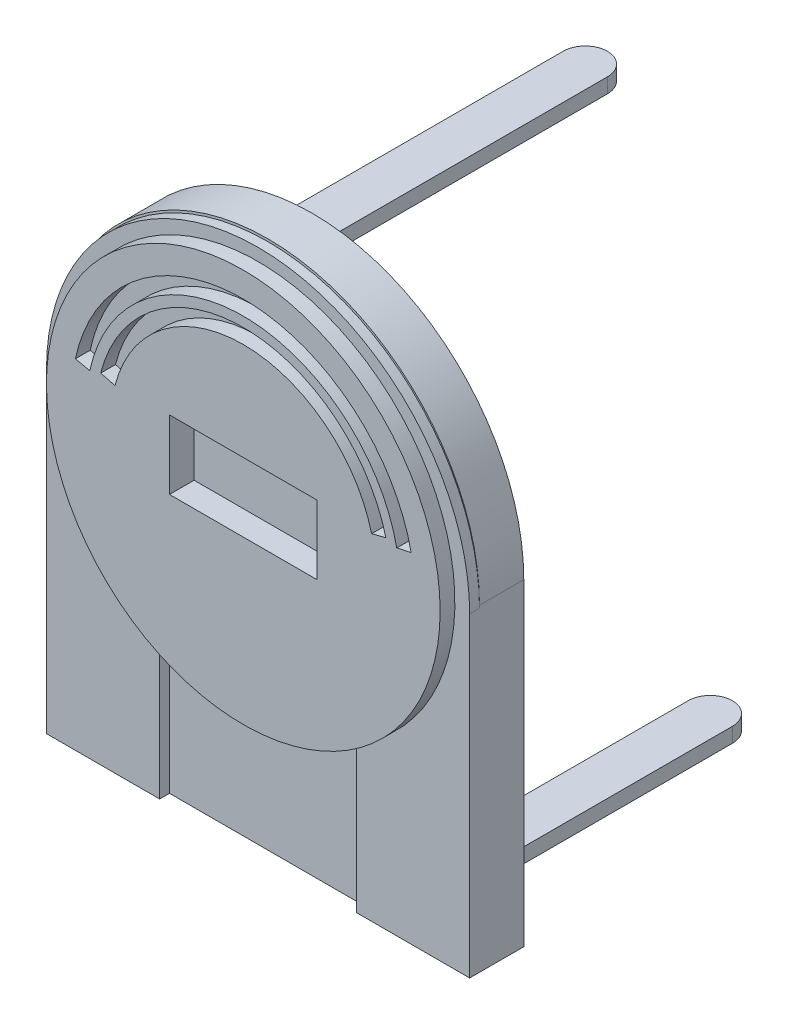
SolidWorks part; units mm, degrees
ref_plane "Face" through (0, 0, 0) normal (0, 0, 1) x (1, 0, 0)
ref_plane "Dessus" through (0, 0, 0) normal (0, 1, 0) x (1, 0, 0)
ref_plane "Droite" through (0, 0, 0) normal (1, 0, 0) x (0, 0, -1)
sketch "Esquisse1" plane through (0, 0, 0) normal (0, 0, 1) x (1, 0, 0)
  line L0 (-9.1364, 0) -> (18.4133, 0) construction
  line L1 (0, 15.4616) -> (0, -6.4658) construction
  line L2 (-9.1364, 10.16) -> (8.293, 10.16) construction
  line L3 (-2.54, 11.2868) -> (-2.54, -1.6571) construction
  line L4 (2.54, 10.9378) -> (2.54, -1.3709) construction
  line L5 (-4.3, 11.6992) -> (-4.3, -1.0854) construction
  line L6 (-4.8945, -0.3) -> (3.5763, -0.3) construction
  line L7 (-5.3386, 10.46) -> (3.5763, 10.46) construction
  line L10 (-4.3, -0.3) -> (4.3, -0.3)
  line L12 (-1.4219, 6.16) -> (1.4647, 6.16) construction
  line L13 (4.3, 6.16) -> (4.3, -0.3)
  line L14 (-4.3, 6.16) -> (-4.3, -0.3)
  arc A1 (4.3, 6.16) -> (-4.3, 6.16) centre (0, 6.16) ccw
  point P21 (0, 10.46)
  point P22 (0, -0.3)
extrude "Base-Extrusion" add sketch "Esquisse1" along normal blind 0.9
sketch "Esquisse2" plane through (0, 0, 0.9) normal (0, 0, 1) x (1, 0, 0)
  line L0 (-4.6624, 6.16) -> (5.4096, 6.16) construction
  line L1 (0, 9.7346) -> (0, 4.2543) construction
  line L2 (-3.3228, 6.86) -> (3.48, 6.86) construction
  line L3 (-3.5097, 5.46) -> (3, 5.46) construction
  line L4 (-1.5, 7.5) -> (-1.5, 5) construction
  line L5 (1.5, 7.5) -> (1.5, 5) construction
  line L6 (-2.607, 6.823) -> (-2.8978, 6.897)
  line L7 (-1.5, 6.86) -> (1.5, 6.86)
  line L8 (-1.5, 6.86) -> (-1.5, 5.46)
  line L9 (-1.5, 5.46) -> (1.5, 5.46)
  line L10 (1.5, 6.86) -> (1.5, 5.46)
  line L11 (-3.1192, 6.8286) -> (-3.4125, 6.8914)
  line L12 (3.1192, 6.8286) -> (3.4125, 6.8914)
  line L13 (2.607, 6.823) -> (2.8978, 6.897)
  circle A0 centre (0, 6.16) radius 4
  arc A3 (2.8978, 6.897) -> (-2.8978, 6.897) centre (0, 6.16) ccw
  arc A4 (3.4125, 6.8914) -> (-3.4125, 6.8914) centre (0, 6.16) ccw
  arc A5 (2.607, 6.823) -> (-2.607, 6.823) centre (0, 6.16) ccw
  arc A6 (3.1192, 6.8286) -> (-3.1192, 6.8286) centre (0, 6.16) ccw
extrude "Boss.-Extru.1" add sketch "Esquisse2" along normal blind 0.5
sketch "Esquisse3" plane through (0, 0, 0) normal (0, 0, -1) x (-1, 0, 0)
  line L0 (-2.5, 10.16) -> (3, 10.16) construction
  line L1 (0, 10.7776) -> (0, -1.0846) construction
  line L2 (-4.8336, 0) -> (5.0982, 0) construction
  line L3 (-2.54, 6.6211) -> (-2.54, -0.602) construction
  line L4 (-2.99, 0.2963) -> (-2.99, -0.2159) construction
  line L5 (-2.09, 0.3335) -> (-2.09, -0.3605) construction
  line L6 (-3.1945, -0.15) -> (-1.3602, -0.15) construction
  line L7 (-3.3226, 0.15) -> (-1.4015, 0.15) construction
  line L8 (-0.45, 0.15) -> (0.45, 0.15)
  line L9 (-2.99, 0.15) -> (-2.09, 0.15)
  line L10 (-2.99, 0.15) -> (-2.99, -0.15)
  line L11 (-2.99, -0.15) -> (-2.09, -0.15)
  line L12 (-2.09, 0.15) -> (-2.09, -0.15)
  line L13 (0.45, 0.15) -> (0.45, -0.15)
  line L14 (-0.45, -0.15) -> (0.45, -0.15)
  line L16 (2.09, 0.15) -> (2.09, -0.15)
  line L17 (2.09, 0.15) -> (2.99, 0.15)
  line L18 (2.99, 0.15) -> (2.99, -0.15)
  line L19 (2.09, -0.15) -> (2.99, -0.15)
  line L20 (-0.45, 10.31) -> (-0.45, 10.01)
  line L21 (-0.45, 10.31) -> (0.45, 10.31)
  line L22 (0.45, 10.31) -> (0.45, 10.01)
  line L23 (-0.45, 10.01) -> (0.45, 10.01)
  line L24 (-0.45, 0.15) -> (-0.45, -0.15)
extrude "Boss.-Extru.2" add sketch "Esquisse3" along normal blind 6
sketch "Esquisse4" plane through (0, 0, 0.9) normal (0, 0, 1) x (1, 0, 0)
  line L0 (0, 10.7455) -> (0, -0.9747) construction
  line L1 (-4.9106, 6.11) -> (6.11, 6.11) construction
  line L2 (-4.3, 2.7453) -> (-4.3, 10.6054) construction
  line L3 (4.3, 2.6208) -> (4.4125, 10.7455) construction
  line L4 (-4.3, 6.11) -> (-4.3, -0.3)
  line L5 (-2, 6.7454) -> (-2, -0.5703) construction
  line L6 (-2, 6.11) -> (-2, -0.3)
  line L7 (-2, -0.3) -> (-4.3, -0.3)
  line L8 (2, 6.11) -> (2, -0.3)
  line L9 (2, -0.3) -> (4.3, -0.3)
  line L10 (4.3, -0.3) -> (4.3, 6.11)
  arc A0 (4.3, 6.11) -> (-4.3, 6.11) centre (0, 6.11) ccw
  arc A1 (2, 6.11) -> (-2, 6.11) centre (0, 6.11) ccw
extrude "Boss.-Extru.3" add sketch "Esquisse4" along normal blind 0.2
fillet "Congé1" radius 0.45
